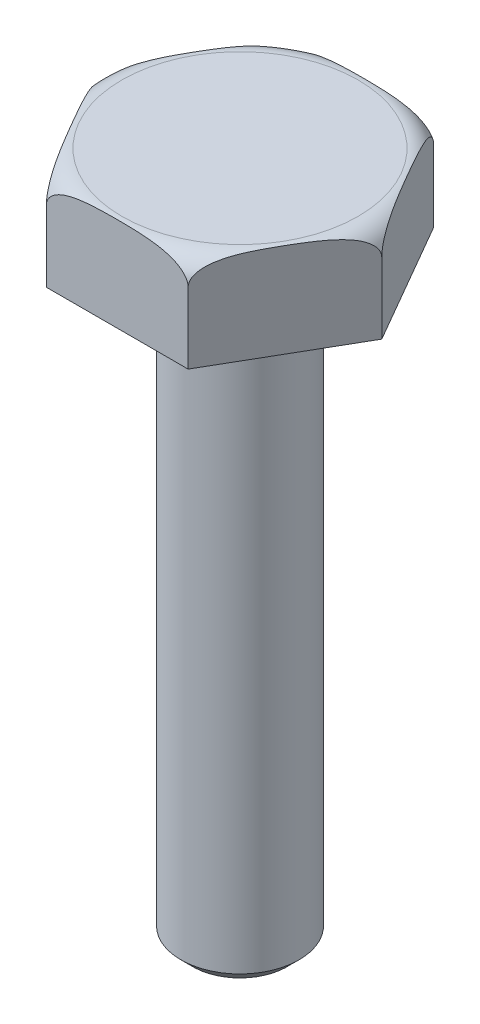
SolidWorks part; units mm, degrees
ref_plane "Front Plane" through (0, 0, 0) normal (0, 0, 1) x (1, 0, 0)
ref_plane "Top Plane" through (0, 0, 0) normal (0, 1, 0) x (1, 0, 0)
ref_plane "Right Plane" through (0, 0, 0) normal (1, 0, 0) x (0, 0, -1)
sketch "Sketch1" plane through (0, 0, 0) normal (0, 1, 0) x (1, 0, 0)
  line L13 (24, 0) -> (12, 20.7846)
  line L14 (12, 20.7846) -> (-12, 20.7846)
  line L15 (-12, 20.7846) -> (-24, 0)
  line L16 (-24, 0) -> (-12, -20.7846)
  line L17 (-12, -20.7846) -> (12, -20.7846)
  line L18 (12, -20.7846) -> (24, 0)
  circle A0 centre (0, 0) radius 20.7846 construction
  dimension "D1" = 24
extrude "Boss-Extrude1" add sketch "Sketch1" along normal blind 16
sketch "Sketch2" plane through (0, 0, 0) normal (0, -1, 0) x (1, 0, 0)
  circle A0 centre (0, 0) radius 10
  dimension "D1" = 20
extrude "Boss-Extrude2" add sketch "Sketch2" along normal blind 100
chamfer "Chamfer1" distance 2 angle 45 1 edges at (0, -100, -10)
sketch "Sketch4" plane through (0, 0, 0) normal (0, 0, 1) x (1, 0, 0)
  line L0 (12, 16) -> (24, 16) construction
  line L1 (24, 16) -> (24, 0) construction
  line L2 (20, 16) -> (24, 16)
  line L3 (24, 16) -> (24, 12)
  arc A0 (20, 16) -> (24, 12) centre (20, 12) cw
  dimension "D1" = 4
  dimension "D2" = 4
revolve "Cut-Revolve1" cut sketch "Sketch4" angle 360 about axis through (0, -100, 0) along (0, 1, 0)
